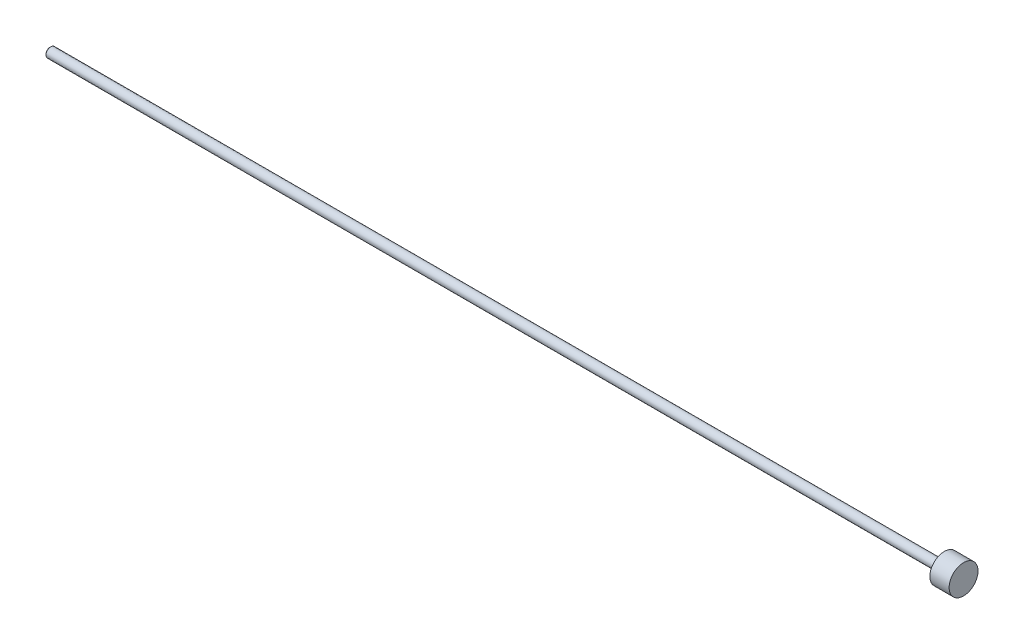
SolidWorks part; units mm, degrees
ref_plane "Front" through (0, 0, 0) normal (0, 0, 1) x (1, 0, 0)
ref_plane "Top" through (0, 0, 0) normal (0, 1, 0) x (1, 0, 0)
ref_plane "Right" through (0, 0, 0) normal (1, 0, 0) x (0, 0, -1)
sketch "Sketch2" plane through (906.0832, 0, 0) normal (-1, 0, 0) x (0, 0, 1)
  circle A0 centre (0, 0) radius 3.175
  dimension "D1" = 6.35
extrude "Main_body" add sketch "Sketch2" along normal up to surface (602.107 mm away)
sketch "Sketch3" plane through (906.0832, 0, 0) normal (-1, 0, 0) x (0, 0, 1)
  circle A0 centre (0, 0) radius 9.525
  circle A1 centre (0, 0) radius 9.525 construction
extrude "Piston Simulation" add sketch "Sketch3" along normal blind 12.7
chamfer "Chamfer1" distance 0.508 angle 45 1 edges at (303.9762, 0, 3.175)
